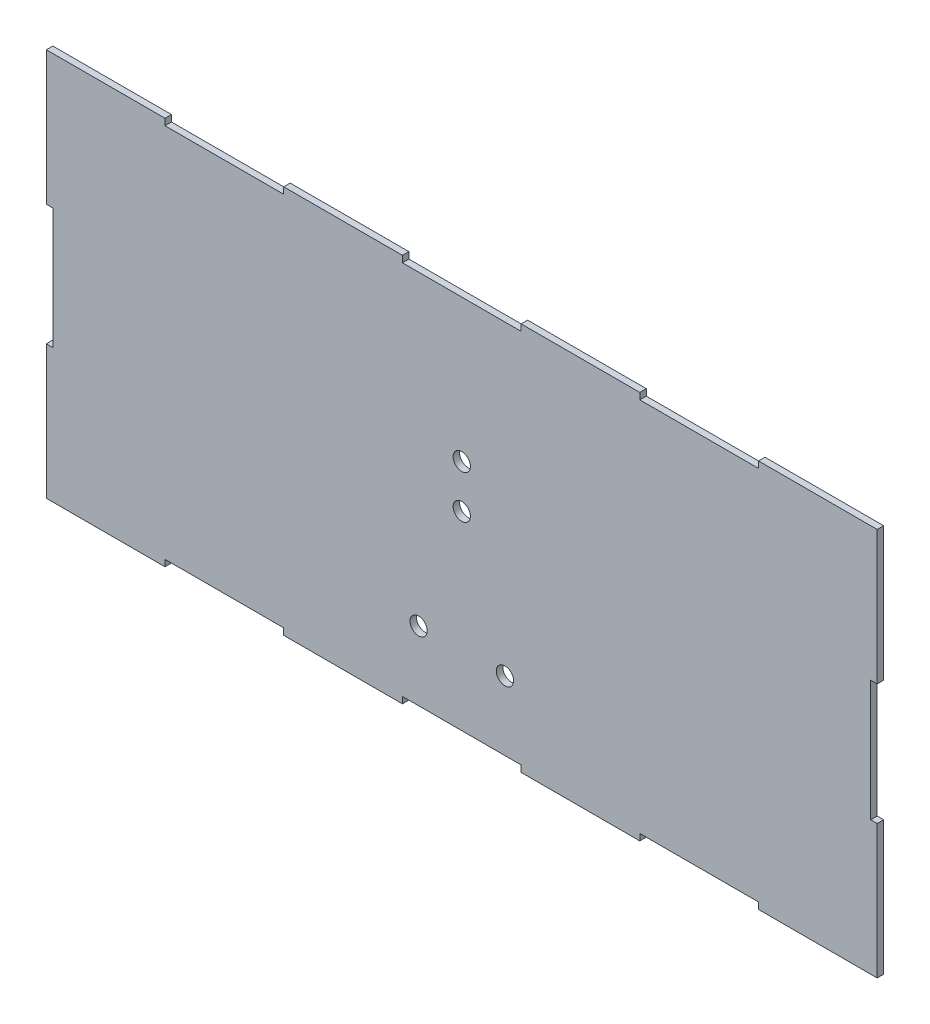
SolidWorks part; units mm, degrees
ref_plane "Plan de face" through (0, 0, 0) normal (0, 0, 1) x (1, 0, 0)
ref_plane "Plan de dessus" through (0, 0, 0) normal (0, 1, 0) x (1, 0, 0)
ref_plane "Plan de droite" through (0, 0, 0) normal (1, 0, 0) x (0, 0, -1)
sketch "Esquisse1" plane through (0, 0, 0) normal (0, 0, 1) x (1, 0, 0)
  line L0 (0, 0) -> (0, -53.5184) construction
  line L1 (-192.5, 90) -> (192.5, 90)
  line L2 (-192.5, 90) -> (-192.5, -90)
  line L3 (-192.5, -90) -> (192.5, -90)
  line L4 (192.5, 90) -> (192.5, -90)
  line L5 (-192.5, 90) -> (192.5, -90) construction
  line L6 (-192.5, -90) -> (192.5, 90) construction
  line L7 (104.2026, -35) -> (-114.6199, -35) construction
  circle A0 centre (-20, -55) radius 4
  circle A1 centre (0, 21) radius 4
  circle A2 centre (0, 1) radius 4
  circle A3 centre (20, -55) radius 4
  point P0 (0, 0)
  dimension "D3" = 8
  dimension "D4" = 40
  dimension "D5" = 20
  dimension "D8" = 35
  dimension "D1" = 385
  dimension "D2" = 180
  dimension "D6" = 36
  dimension "D7" = 56
extrude "Boss.-Extru.1" add sketch "Esquisse1" along normal blind 3
sketch "Esquisse2" plane through (0, 0, 3) normal (0, 0, 1) x (1, 0, 0)
  line L0 (0, -90) -> (0, 112.0016) construction
  line L1 (-192.5, -90) -> (192.5, -90) construction
  line L2 (-192.5, 0) -> (308.2384, 0) construction
  line L3 (-192.5, 90) -> (-192.5, -90) construction
  line L4 (82.5, -90) -> (82.5, -87)
  line L5 (-137.5, -90) -> (-82.5, -90)
  line L6 (-137.5, -90) -> (-137.5, -87)
  line L7 (-137.5, -87) -> (-82.5, -87)
  line L8 (-82.5, -90) -> (-82.5, -87)
  line L9 (-27.5, -87) -> (27.5, -87)
  line L10 (-27.5, -87) -> (-27.5, -90)
  line L11 (-27.5, -90) -> (27.5, -90)
  line L12 (27.5, -87) -> (27.5, -90)
  line L13 (-27.5, -87) -> (27.5, -90) construction
  line L14 (-27.5, -90) -> (27.5, -87) construction
  line L15 (137.5, -87) -> (82.5, -87)
  line L16 (137.5, -90) -> (137.5, -87)
  line L17 (137.5, -90) -> (82.5, -90)
  line L18 (-27.5, 90) -> (27.5, 87) construction
  line L19 (-27.5, 87) -> (27.5, 90) construction
  line L20 (137.5, 90) -> (82.5, 90)
  line L21 (137.5, 90) -> (137.5, 87)
  line L22 (137.5, 87) -> (82.5, 87)
  line L23 (27.5, 87) -> (27.5, 90)
  line L24 (-27.5, 90) -> (27.5, 90)
  line L25 (-27.5, 87) -> (-27.5, 90)
  line L26 (-27.5, 87) -> (27.5, 87)
  line L27 (-82.5, 90) -> (-82.5, 87)
  line L28 (-137.5, 87) -> (-82.5, 87)
  line L29 (-137.5, 90) -> (-137.5, 87)
  line L30 (-137.5, 90) -> (-82.5, 90)
  line L31 (82.5, 90) -> (82.5, 87)
  line L32 (189.5, 28) -> (192.5, -28) construction
  line L33 (-189.5, -28) -> (-192.5, -28)
  line L34 (-189.5, -28) -> (-189.5, 28)
  line L35 (-189.5, 28) -> (-192.5, 28)
  line L36 (-192.5, -28) -> (-192.5, 28)
  line L37 (-189.5, -28) -> (-192.5, 28) construction
  line L38 (-189.5, 28) -> (-192.5, -28) construction
  line L39 (189.5, -28) -> (192.5, 28) construction
  line L40 (192.5, -28) -> (192.5, 28)
  line L41 (189.5, 28) -> (192.5, 28)
  line L42 (189.5, -28) -> (189.5, 28)
  line L43 (189.5, -28) -> (192.5, -28)
  point P13 (0, -88.5)
  point P34 (0, 88.5)
  point P35 (-191, 0)
  point P44 (191, 0)
  dimension "D1" = 3
  dimension "D2" = 55
  dimension "D3" = 55
  dimension "D4" = 56
  dimension "D5" = 3
extrude "Enlèv. mat.-Extru.1" cut sketch "Esquisse2" against normal through all
sketch "Gravure repère angle" plane through (0, 0, 3) normal (0, 0, 1) x (1, 0, 0)
  line L0 (0, 21) -> (-64, 21)
  line L1 (0, 21) -> (-45.2548, 66.2548)
  line L2 (0, 21) -> (0, 85)
  line L3 (0, 21) -> (45.2548, 66.2548)
  line L4 (0, 21) -> (64, 21)
  line L5 (0, 1) -> (-46, 1)
  line L6 (0, 1) -> (-32.5269, 33.5269)
  line L8 (0, 1) -> (32.5269, 33.5269)
  line L9 (0, 1) -> (46, 1)
  line L10 (0, 1) -> (0, 47)
  point P11 (0, 21)
  point P19 (0, 1)
  dimension "D3" = 64
  dimension "D4" = 46
  dimension "D1" = 5
  dimension "D2" = 5
